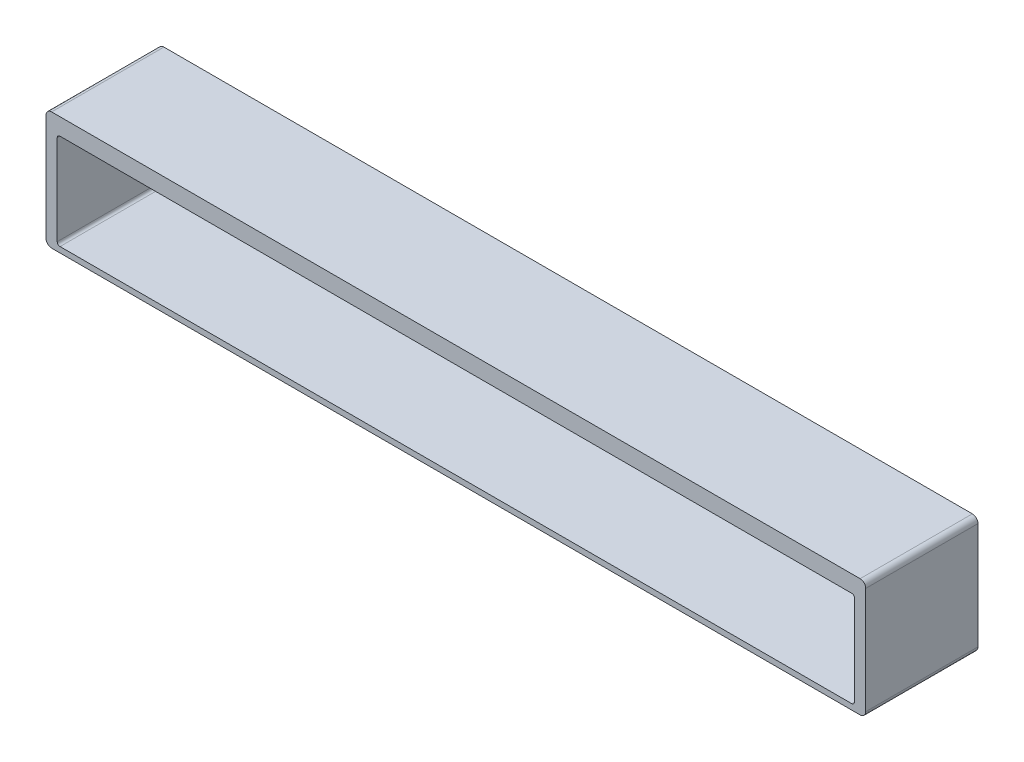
SolidWorks part; units mm, degrees
ref_plane "Front Plane" through (0, 0, 0) normal (0, 0, 1) x (1, 0, 0)
ref_plane "Top Plane" through (0, 0, 0) normal (0, 1, 0) x (1, 0, 0)
ref_plane "Right Plane" through (0, 0, 0) normal (1, 0, 0) x (0, 0, -1)
ref_plane "Ebene3" through (-90.21, -6.1077, 22.5) normal (1, 0, 0) x (0, 0, -1)
ref_plane "Ebene4" through (-91.21, -7.1077, -99.5) normal (0, 1, 0) x (-1, 0, 0)
sketch "Skizze17" plane through (0, 0, -12.6188) normal (0, 0, 1) x (1, 0, 0)
  line L0 (-23.7526, -7.6077) -> (-85.6673, -7.6077) construction
  line L1 (-88.21, -7.6077) -> (-21.21, -7.6077)
  line L2 (-88.21, -7.6077) -> (-88.21, -6.1077)
  line L3 (-88.21, -6.1077) -> (-21.21, -6.1077)
  line L4 (-21.21, -7.6077) -> (-21.21, -6.1077)
  line L5 (-90.21, -6.1077) -> (-19.21, -6.1077) construction
  line L6 (-90.21, -8.6077) -> (-90.21, -7.6077) construction
  line L8 (-19.21, -8.6077) -> (-19.21, -10.6077) construction
  dimension "D1" = 2
  dimension "D3" = 2
extrude "Linear austragen1" add sketch "Skizze17" against normal up to surface (86.3812 mm away)
sketch "Skizze19" plane through (-21.21, 0, 0) normal (1, 0, 0) x (0, 0, -1)
  line L1 (99, -7.6077) -> (99, -6.1077) construction
  line L2 (99, -6.1077) -> (100, -6.1077)
  line L3 (99, -6.1077) -> (99, -16.6171)
  line L4 (99, -16.6171) -> (100, -16.6171)
  line L5 (100, -6.1077) -> (100, -16.6171)
  dimension "D1" = 1
extrude "Linear austragen2" add sketch "Skizze19" against normal up to surface (67 mm away)
sketch "Skizze23" plane through (-90.21, 0, 0) normal (-1, 0, 0) x (0, 0, 1)
  line L0 (-99, -7.6077) -> (-12.6188, -7.6077) construction
  line L1 (-100, -6.1077) -> (-12.6188, -6.1077)
  line L2 (-100, -6.1077) -> (-100, -7.6077)
  line L3 (-100, -7.6077) -> (-12.6188, -7.6077)
  line L4 (-12.6188, -6.1077) -> (-12.6188, -7.6077)
  line L5 (-100, -16.6171) -> (-100, -6.1077) construction
  line L6 (-100, -6.1077) -> (-12.6188, -6.1077) construction
  line L7 (-12.6188, -6.1077) -> (-12.6188, -7.6077) construction
extrude "Linear austragen3" add sketch "Skizze23" against normal up to surface (2 mm away)
sketch "Skizze24" plane through (-19.21, 0, 0) normal (1, 0, 0) x (0, 0, -1)
  line L1 (12.6188, -7.6077) -> (100, -7.6077)
  line L2 (12.6188, -7.6077) -> (12.6188, -6.1077)
  line L3 (12.6188, -6.1077) -> (100, -6.1077)
  line L4 (100, -7.6077) -> (100, -6.1077)
  line L7 (12.6188, -7.6077) -> (12.6188, -6.1077) construction
  line L8 (99, -7.6077) -> (12.6188, -7.6077) construction
  line L9 (100, -6.1077) -> (12.6188, -6.1077) construction
  line L10 (100, -16.6171) -> (100, -6.1077) construction
extrude "Linear austragen4" add sketch "Skizze24" against normal up to surface (2 mm away)
sketch "Skizze25" plane through (0, -16.6171, 0) normal (0, -1, 0) x (1, 0, 0)
  line L0 (-19.21, -12.6188) -> (-19.21, -100) construction
  line L1 (-21.21, -100) -> (-19.21, -100)
  line L2 (-21.21, -100) -> (-21.21, -99)
  line L3 (-21.21, -99) -> (-19.21, -99)
  line L4 (-19.21, -100) -> (-19.21, -99)
  line L5 (-88.21, -100) -> (-21.21, -100) construction
  line L6 (-21.21, -99) -> (-23.7526, -99) construction
extrude "Linear austragen5" add sketch "Skizze25" against normal up to surface (9.0094 mm away)
sketch "Skizze26" plane through (0, -16.6171, 0) normal (0, -1, 0) x (1, 0, 0)
  line L0 (-23.7526, -99) -> (-93.6741, -99) construction
  line L1 (-88.21, -100) -> (-90.21, -100)
  line L2 (-88.21, -100) -> (-88.21, -99)
  line L3 (-88.21, -99) -> (-90.21, -99)
  line L4 (-90.21, -100) -> (-90.21, -99)
  line L6 (-90.21, -100) -> (-90.21, -12.6188) construction
extrude "Linear austragen6" add sketch "Skizze26" against normal up to surface (9.0094 mm away)
sketch "Skizze27" plane through (0, -6.1077, 0) normal (0, 1, 0) x (1, 0, 0)
  line L0 (-19.21, 12.6188) -> (-90.21, 12.6188) construction
  line L1 (-90.21, 12.6188) -> (-91.21, 12.6188)
  line L2 (-90.21, 12.6188) -> (-90.21, 100)
  line L3 (-90.21, 100) -> (-91.21, 100)
  line L4 (-91.21, 12.6188) -> (-91.21, 100)
  line L5 (-90.21, 100) -> (-19.21, 100) construction
  line L6 (-90.21, 12.6188) -> (-90.21, 100) construction
  dimension "D1" = 1
extrude "Linear austragen7" add sketch "Skizze27" against normal up to surface (10.5094 mm away)
sketch "Skizze29" plane through (0, -6.1077, 0) normal (0, 1, 0) x (1, 0, 0)
  line L1 (-19.21, 12.6188) -> (-18.21, 12.6188)
  line L2 (-19.21, 12.6188) -> (-19.21, 100)
  line L3 (-19.21, 100) -> (-18.21, 100)
  line L4 (-18.21, 12.6188) -> (-18.21, 100)
  line L6 (-19.21, 12.6188) -> (-91.21, 12.6188) construction
  line L8 (-91.21, 100) -> (-19.21, 100) construction
  line L9 (-19.21, 100) -> (-19.21, 12.6188) construction
  dimension "D1" = 1
extrude "Linear austragen8" add sketch "Skizze29" against normal up to surface (10.5094 mm away)
sketch "Skizze36" plane through (0, 0, -12.6188) normal (0, 0, 1) x (1, 0, 0)
  line L1 (-18.21, -16.1171) -> (-91.21, -16.1171)
  line L2 (-18.21, -16.1171) -> (-18.21, -16.6171)
  line L3 (-18.21, -16.6171) -> (-91.21, -16.6171)
  line L4 (-91.21, -16.1171) -> (-91.21, -16.6171)
  line L5 (-91.21, -16.6171) -> (-91.21, -6.1077) construction
  line L6 (-18.21, -16.6171) -> (-18.21, -6.1077) construction
  line L7 (-90.21, -16.6171) -> (-19.21, -16.6171) construction
  dimension "D1" = 0.5
extrude "Linear austragen9" add sketch "Skizze36" against normal up to surface (87.3812 mm away)
sketch "Skizze37" plane through (-91.21, 0, 0) normal (-1, 0, 0) x (0, 0, 1)
  line L0 (-100, -16.6171) -> (-100, -6.1077) construction
  line L1 (-10, -40.6709) -> (-90, -40.6709)
  line L2 (-10, -40.6709) -> (-10, 5.4889)
  line L3 (-10, 5.4889) -> (-90, 5.4889)
  line L4 (-90, -40.6709) -> (-90, 5.4889)
  dimension "D1" = 10
  dimension "D2" = 80
extrude "Schnitt-Linear austragen1" cut sketch "Skizze37" against normal through all
fillet "Verrundung1" radius 0.25 4 edges at (-19.21, -16.1171, -94.5) (-90.21, -16.1171, -94.5)
fillet "Verrundung2" radius 0.5 4 edges at (-18.21, -16.6171, -95) (-18.21, -6.1077, -95) (-91.21, -6.1077, -95) (-91.21, -16.6171, -95)
